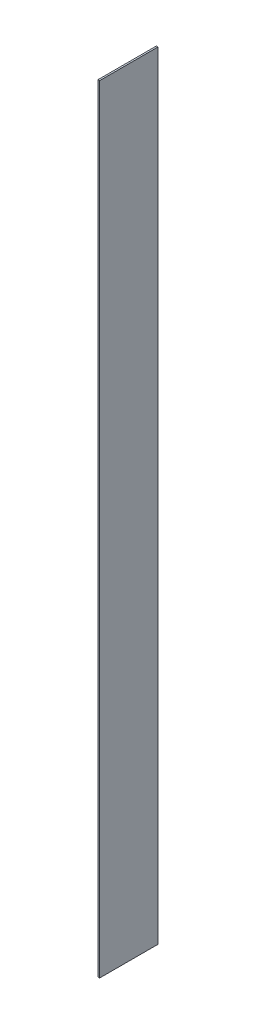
SolidWorks part; units mm, degrees
ref_plane "Front Plane" through (0, 0, 0) normal (1, 0, 0) x (0, 1, 0)
ref_plane "Top Plane" through (0, 0, 0) normal (0, 0, 1) x (0, 1, 0)
ref_plane "Right Plane" through (0, 0, 0) normal (0, 1, 0) x (-1, 0, 0)
sketch "Sketch1" plane through (0, 0, 0) normal (0, 1, 0) x (-1, 0, 0)
  line L1 (-19.05, 673.0062) -> (19.05, 673.0062)
  line L2 (-19.05, 673.0062) -> (-19.05, -673.0063)
  line L3 (-19.05, -673.0063) -> (19.05, -673.0063)
  line L4 (19.05, 673.0062) -> (19.05, -673.0063)
  line L5 (-19.05, 673.0062) -> (19.05, -673.0063) construction
  line L6 (-19.05, -673.0063) -> (19.05, 673.0062) construction
  point P0 (0, 0)
  dimension "D1" = 1346.0125
  dimension "D2" = 38.1
extrude "Boss-Extrude1" add sketch "Sketch1" along normal mid plane 17946.825
ref_plane "Mating plane" through (0, 0, -923.0063) normal (0, 0, -1) x (0, 1, 0)
chamfer "Chamfer1" [suppressed] distance 13 angle 45
